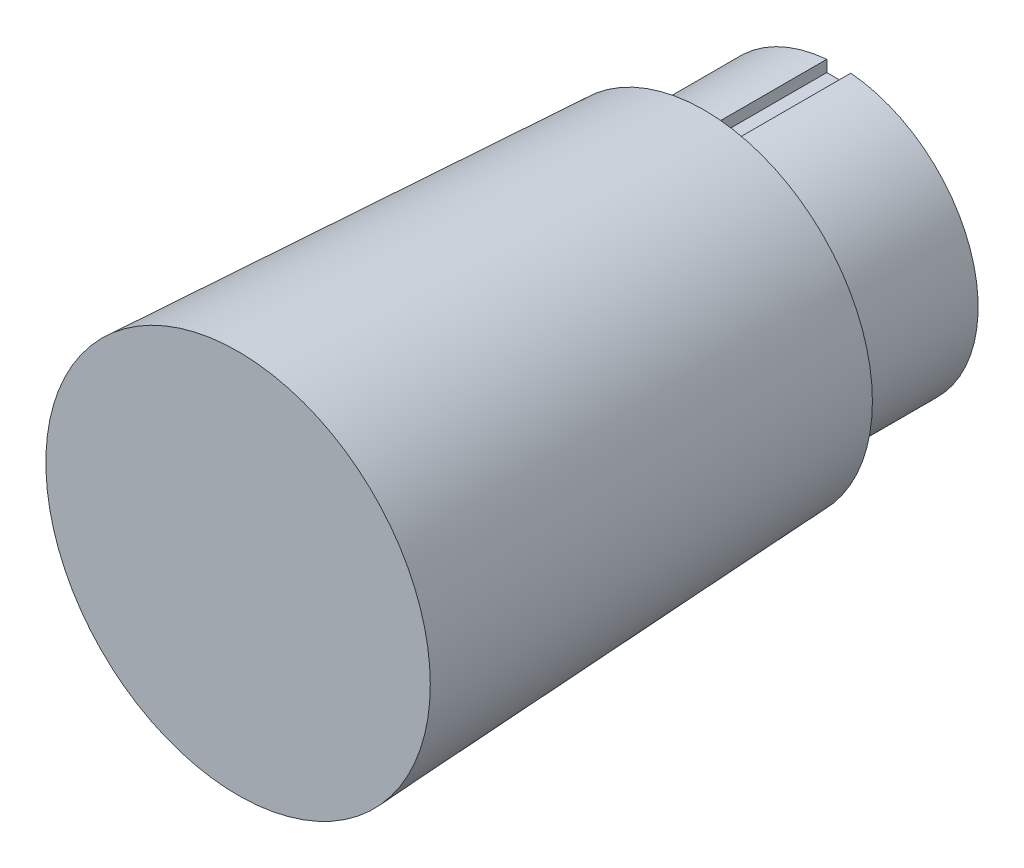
SolidWorks part; units mm, degrees
ref_plane "Alzado" through (0, 0, 0) normal (0, 0, 1) x (1, 0, 0)
ref_plane "Planta" through (0, 0, 0) normal (0, 1, 0) x (1, 0, 0)
ref_plane "Vista lateral" through (0, 0, 0) normal (1, 0, 0) x (0, 0, -1)
sketch "Croquis1" plane through (0, 0, 0) normal (1, 0, 0) x (0, 0, -1)
  line L0 (0, 0) -> (125, 0) construction
  line L1 (0, 0) -> (0, 40)
  line L2 (125, 29) -> (97, 29)
  line L3 (125, 29) -> (125, 0)
  line L4 (97, 29) -> (97, 35)
  line L5 (97, 35) -> (0, 40)
  line L6 (125, 0) -> (0, 0)
  dimension "D1" = 80
  dimension "D2" = 125
  dimension "D3" = 58
  dimension "D4" = 70
  dimension "D5" = 28
revolve "Revolución1" add sketch "Croquis1" angle 360 about L0
sketch "Croquis2" plane through (0, 0, -125) normal (0, 0, -1) x (-1, 0, 0)
  line L1 (2.5, 31.5) -> (-2.5, 31.5)
  line L2 (2.5, 31.5) -> (2.5, 26.5)
  line L3 (2.5, 26.5) -> (-2.5, 26.5)
  line L4 (-2.5, 31.5) -> (-2.5, 26.5)
  line L5 (2.5, 31.5) -> (-2.5, 26.5) construction
  line L6 (2.5, 26.5) -> (-2.5, 31.5) construction
  circle A0 centre (0, 0) radius 29 construction
  circle A1 centre (0, 0) radius 29 construction
  point P0 (0, 29)
  point P9 (0, 0)
  dimension "D1" = 5
  dimension "D2" = 5
extrude "Cortar-Extruir1" cut sketch "Croquis2" against normal up to surface (28 mm away)
